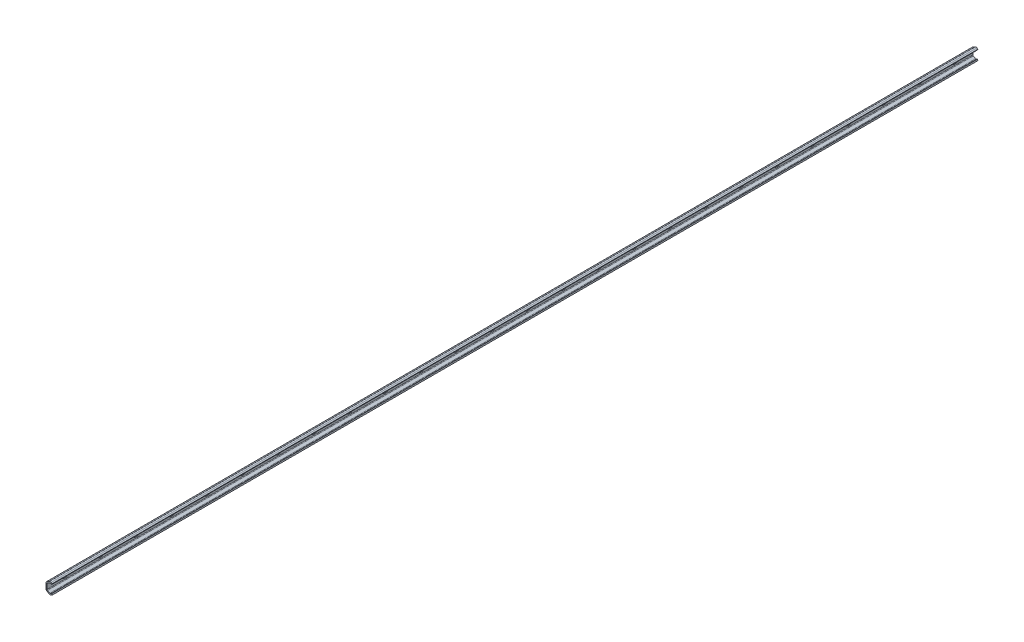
SolidWorks part; units mm, degrees
ref_plane "Front Plane" through (0, 0, 0) normal (0, 0, 1) x (1, 0, 0)
ref_plane "Top Plane" through (0, 0, 0) normal (0, 1, 0) x (1, 0, 0)
ref_plane "Right Plane" through (0, 0, 0) normal (1, 0, 0) x (0, 0, -1)
sketch "Sketch1" plane through (0, 0, 0) normal (0, 0, 1) x (1, 0, 0)
  line L0 (12.7499, 8.8877) -> (14, 11.0528)
  line L1 (14, 11.0528) -> (11.5, 12.4962)
  line L2 (7.4998, 12.4962) -> (1.9999, 9.3207)
  line L3 (0, 5.8567) -> (0, -5.8567)
  line L4 (1.9999, -9.3207) -> (7.4998, -12.4962)
  line L5 (11.5, -12.4962) -> (14, -11.0528)
  line L6 (14, -11.0528) -> (12.7499, -8.8877)
  line L7 (12.7499, -8.8877) -> (10.4999, -10.1867)
  line L8 (8.4998, -10.1867) -> (3.5001, -7.3)
  line L10 (2.5002, -5.568) -> (2.5002, 0)
  line L11 (2.5002, 0) -> (2.5002, 5.568)
  line L12 (3.5001, 7.3) -> (8.4998, 10.1867)
  line L13 (10.4999, 10.1867) -> (12.7499, 8.8877)
  arc A0 (11.5, 12.4962) -> (7.4998, 12.4962) centre (9.4999, 9.032) ccw
  arc A1 (1.9999, 9.3207) -> (0, 5.8567) centre (4, 5.8567) ccw
  arc A2 (0, -5.8567) -> (1.9999, -9.3207) centre (4, -5.8567) ccw
  arc A3 (7.4998, -12.4962) -> (11.5, -12.4962) centre (9.4999, -9.032) ccw
  arc A4 (10.4999, -10.1867) -> (8.4998, -10.1867) centre (9.4999, -8.4547) cw
  arc A6 (2.5002, 5.568) -> (3.5001, 7.3) centre (4.5002, 5.568) cw
  arc A7 (8.4998, 10.1867) -> (10.4999, 10.1867) centre (9.4999, 8.4547) cw
  arc A8 (2.5002, -5.568) -> (3.5001, -7.3) centre (4.5002, -5.568) ccw
  point P50 (0, 0)
  dimension "D1" = 4.0001
  dimension "D2" = 4
  dimension "D3" = 1.9999
  dimension "D4" = 2
  dimension "D5" = 2.5002
  dimension "D6" = 7.4998
  dimension "D7" = 12.7499
  dimension "D8" = 14
  dimension "D9" = 5.568
extrude "Boss-Extrude1" add sketch "Sketch1" against normal blind 2080 contours L11 A6 L12 A7 L13 L0 L1 A0 L2 A1 L3 A2 L4 A3 L5 L6 L7 A4 L8 A8 L10
sketch "Sketch2" plane through (2.5002, 0, 0) normal (1, 0, 0) x (0, 0, -1)
  line L0 (37.5, 0) -> (42.5, 0) construction
  line L1 (37.5, 3) -> (42.5, 3)
  line L2 (37.5, -3) -> (42.5, -3)
  arc A0 (37.5, 3) -> (37.5, -3) centre (37.5, 0) ccw
  arc A1 (42.5, -3) -> (42.5, 3) centre (42.5, 0) ccw
  point P2 (40, 0)
  point P9 (40, 3)
  dimension "D1" = 5
  dimension "D2" = 6
  dimension "D3" = 40
extrude "Cut-Extrude1" cut sketch "Sketch2" against normal through all
pattern_linear "LPattern1" count 26 spacing 80 along (0, 0, -1) of "Cut-Extrude1"
